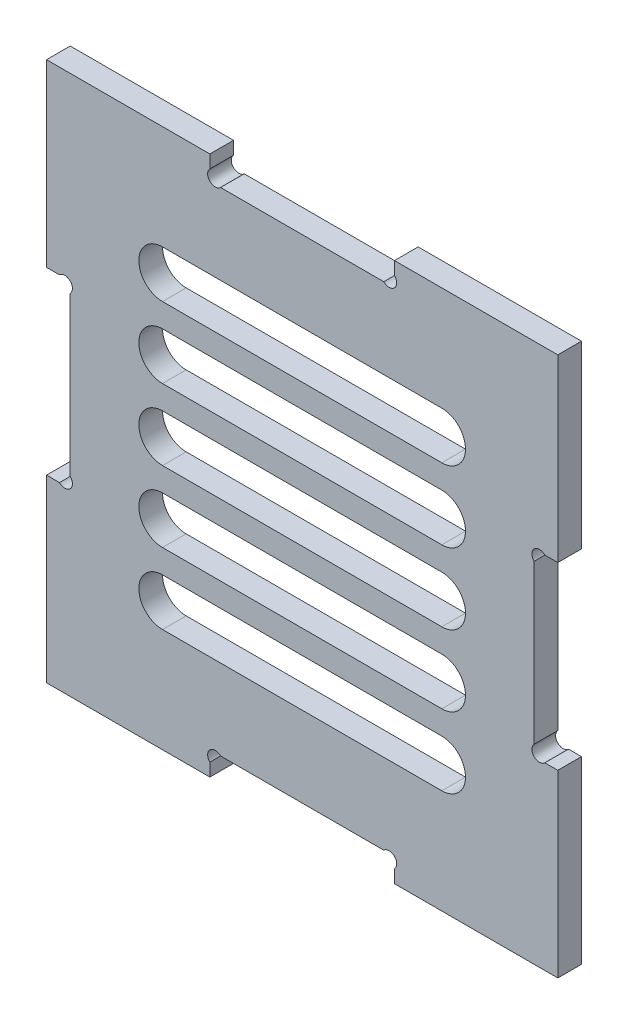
SolidWorks part; units mm, degrees
ref_plane "Plan de face" through (0, 0, 0) normal (0, 0, 1) x (1, 0, 0)
ref_plane "Plan de dessus" through (0, 0, 0) normal (0, 1, 0) x (1, 0, 0)
ref_plane "Plan de droite" through (0, 0, 0) normal (1, 0, 0) x (0, 0, -1)
sketch "Esquisse1" plane through (0, 0, 0) normal (0, 0, 1) x (1, 0, 0)
  line L0 (41.7466, -92.9541) -> (41.7466, -66.2413) construction
  line L1 (47.1552, -70.4454) -> (10.525, -70.4454) construction
  line L2 (71.2466, -6.4139) -> (71.2466, -43.2075) construction
  line L3 (90.3435, -37.4454) -> (66.19, -37.4454) construction
  line L4 (41.7466, -70.4454) -> (30.2004, -81.9915) construction
  line L5 (71.2466, -37.4454) -> (84.2453, -24.4467) construction
  line L6 (73.5093, -37.4454) -> (76.2466, -37.4454)
  line L7 (76.2466, -37.4454) -> (76.2466, -75.4454)
  line L8 (76.2466, -75.4454) -> (41.7466, -75.4454)
  line L9 (41.7466, -75.4454) -> (41.7466, -72.7082)
  line L10 (41.7466, 38.5546) -> (41.7466, 35.8173)
  line L11 (76.2466, 38.5546) -> (41.7466, 38.5546)
  line L12 (76.2466, 0.5546) -> (76.2466, 38.5546)
  line L13 (73.5093, 0.5546) -> (76.2466, 0.5546)
  line L14 (-29.0162, 0.5546) -> (-31.7534, 0.5546)
  line L15 (-31.7534, 0.5546) -> (-31.7534, 38.5546)
  line L16 (-31.7534, 38.5546) -> (2.7466, 38.5546)
  line L17 (2.7466, 38.5546) -> (2.7466, 35.8173)
  line L18 (2.7466, -75.4454) -> (2.7466, -72.7082)
  line L19 (-31.7534, -75.4454) -> (2.7466, -75.4454)
  line L20 (-31.7534, -37.4454) -> (-31.7534, -75.4454)
  line L21 (-29.0162, -37.4454) -> (-31.7534, -37.4454)
  line L22 (39.4838, 33.5546) -> (5.0093, 33.5546)
  line L23 (-26.7534, -1.7082) -> (-26.7534, -35.1827)
  line L24 (71.2466, -35.1827) -> (71.2466, -1.7082)
  line L25 (39.4838, -70.4454) -> (5.0093, -70.4454)
  line L26 (51.7466, 3.9408) -> (51.7466, -60.2684) construction
  line L27 (51.7466, -60.2684) -> (51.7466, -37.4454) construction
  line L28 (51.7466, -23.4454) -> (-7.2534, -23.4454)
  line L29 (101.0301, -18.4454) -> (10.525, -18.4454) construction
  line L30 (101.0301, -75.4454) -> (10.525, -75.4454) construction
  line L31 (22.2466, 46.6534) -> (22.2466, -111.3491) construction
  line L32 (76.2466, -111.3491) -> (76.2466, -12.5497) construction
  line L33 (51.7466, -13.4454) -> (-7.2534, -13.4454)
  line L34 (51.7466, -8.4454) -> (-7.2534, -8.4454)
  line L35 (51.7466, 1.5546) -> (-7.2534, 1.5546)
  line L36 (51.7466, 6.5546) -> (-7.2534, 6.5546)
  line L37 (51.7466, 16.5546) -> (-7.2534, 16.5546)
  line L38 (51.7466, -28.4454) -> (-7.2534, -28.4454)
  line L39 (51.7466, -38.4454) -> (-7.2534, -38.4454)
  line L40 (51.7466, -43.4454) -> (-7.2534, -43.4454)
  line L41 (51.7466, -53.4454) -> (-7.2534, -53.4454)
  arc A0 (41.7466, -72.7082) -> (39.4838, -70.4454) centre (40.6152, -71.5768) ccw
  arc A1 (71.2466, -35.1827) -> (73.5093, -37.4454) centre (72.3779, -36.3141) ccw
  arc A2 (41.7466, 35.8173) -> (39.4838, 33.5546) centre (40.6152, 34.6859) cw
  arc A3 (71.2466, -1.7082) -> (73.5093, 0.5546) centre (72.3779, -0.5768) cw
  arc A4 (-26.7534, -1.7082) -> (-29.0162, 0.5546) centre (-27.8848, -0.5768) ccw
  arc A5 (2.7466, 35.8173) -> (5.0093, 33.5546) centre (3.8779, 34.6859) ccw
  arc A6 (2.7466, -72.7082) -> (5.0093, -70.4454) centre (3.8779, -71.5768) cw
  arc A7 (-26.7534, -35.1827) -> (-29.0162, -37.4454) centre (-27.8848, -36.3141) cw
  arc A8 (51.7466, -23.4454) -> (51.7466, -13.4454) centre (51.7466, -18.4454) ccw
  arc A9 (-7.2534, -23.4454) -> (-7.2534, -13.4454) centre (-7.2534, -18.4454) cw
  arc A10 (51.7466, -8.4454) -> (51.7466, 1.5546) centre (51.7466, -3.4454) ccw
  arc A11 (-7.2534, -8.4454) -> (-7.2534, 1.5546) centre (-7.2534, -3.4454) cw
  arc A12 (51.7466, 6.5546) -> (51.7466, 16.5546) centre (51.7466, 11.5546) ccw
  arc A13 (-7.2534, 6.5546) -> (-7.2534, 16.5546) centre (-7.2534, 11.5546) cw
  arc A14 (51.7466, -38.4454) -> (51.7466, -28.4454) centre (51.7466, -33.4454) ccw
  arc A15 (-7.2534, -38.4454) -> (-7.2534, -28.4454) centre (-7.2534, -33.4454) cw
  arc A16 (51.7466, -53.4454) -> (51.7466, -43.4454) centre (51.7466, -48.4454) ccw
  arc A17 (-7.2534, -53.4454) -> (-7.2534, -43.4454) centre (-7.2534, -48.4454) cw
  dimension "D5" = 38
  dimension "D6" = 5
  dimension "D8" = 45
  dimension "D9" = 19.5
  dimension "D10" = 3
  dimension "D1" = 54
  dimension "D2" = 57
  dimension "D3" = 5
  dimension "D4" = 34.5
  dimension "D7" = 45
  dimension "D11" = 3
extrude "Boss.-Extru.1" add sketch "Esquisse1" along normal blind 5
